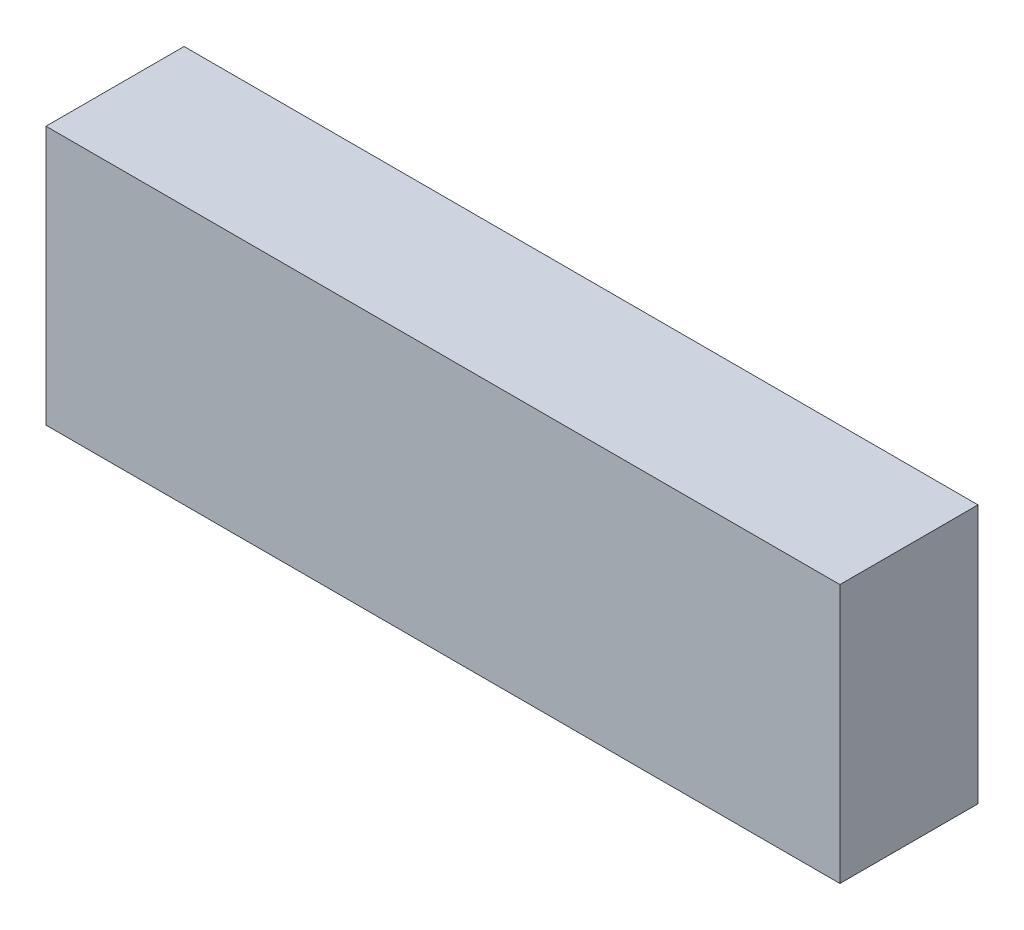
SolidWorks part; units mm, degrees
ref_plane "Front Plane" through (0, 0, 0) normal (0, 0, 1) x (1, 0, 0)
ref_plane "Top Plane" through (0, 0, 0) normal (0, 1, 0) x (1, 0, 0)
ref_plane "Right Plane" through (0, 0, 0) normal (1, 0, 0) x (0, 0, -1)
sketch "Sketch1" plane through (0, 0, 0) normal (0, 1, 0) x (1, 0, 0)
  line L1 (-115, 20) -> (115, 20)
  line L2 (-115, 20) -> (-115, -20)
  line L3 (-115, -20) -> (115, -20)
  line L4 (115, 20) -> (115, -20)
  line L5 (-115, 20) -> (115, -20) construction
  line L6 (-115, -20) -> (115, 20) construction
  point P0 (0, 0)
  dimension "D1" = 230
  dimension "D2" = 40
extrude "Boss-Extrude1" add sketch "Sketch1" along normal mid plane 75
